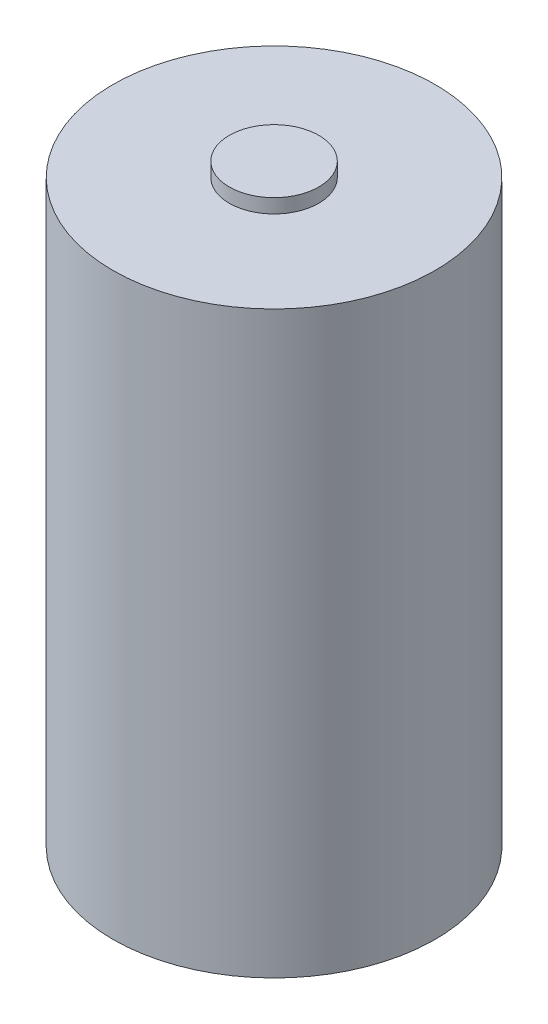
SolidWorks part; units mm, degrees
ref_plane "Front Plane" through (0, 0, 0) normal (0, 0, 1) x (1, 0, 0)
ref_plane "Top Plane" through (0, 0, 0) normal (0, 1, 0) x (1, 0, 0)
ref_plane "Right Plane" through (0, 0, 0) normal (1, 0, 0) x (0, 0, -1)
sketch "Sketch1" plane through (0, 0, 0) normal (0, 1, 0) x (1, 0, 0)
  circle A0 centre (0, 0) radius 17.1
  dimension "D1" = 34.2
extrude "Extrude1" add sketch "Sketch1" along normal blind 61.5
sketch "Sketch2" plane through (0, 61.5, 0) normal (0, 1, 0) x (-1, 0, 0)
  circle A0 centre (0, 0) radius 4.75
extrude "Extrude2" add sketch "Sketch2" along normal blind 1.5
